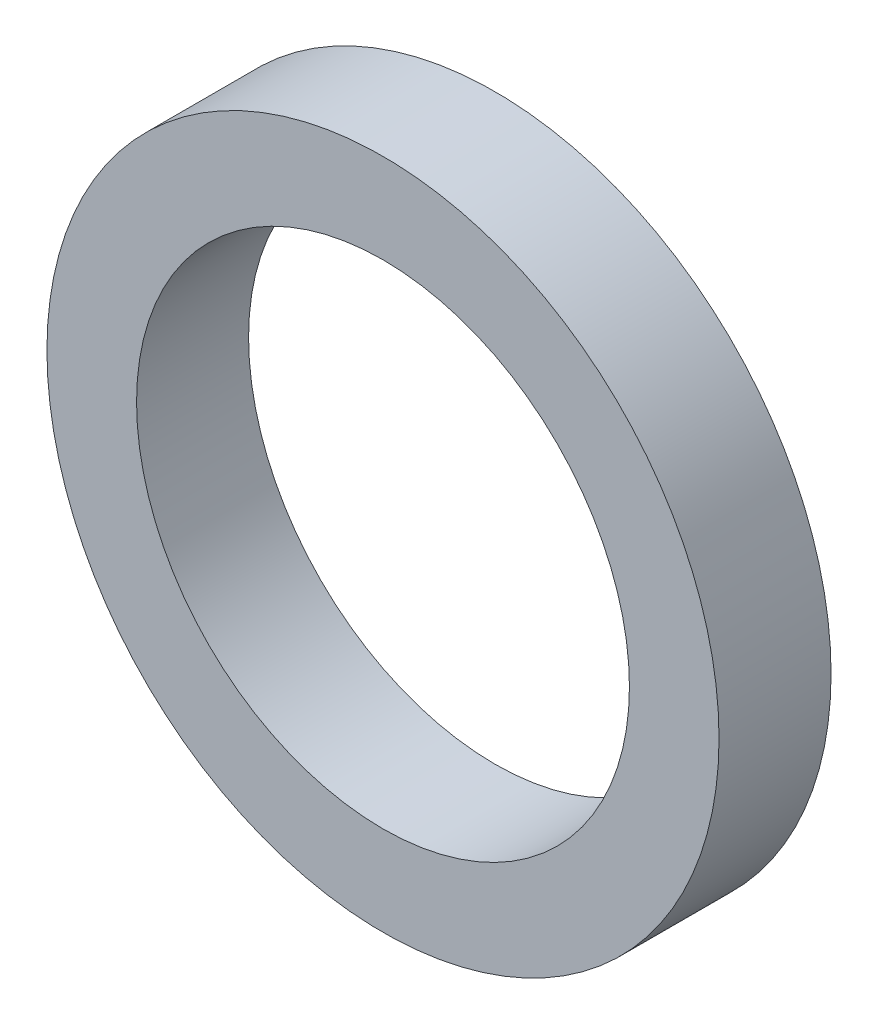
SolidWorks part; units mm, degrees
ref_plane "Plan de face" through (0, 0, 0) normal (0, 0, 1) x (1, 0, 0)
ref_plane "Plan de dessus" through (0, 0, 0) normal (0, 1, 0) x (1, 0, 0)
ref_plane "Plan de droite" through (0, 0, 0) normal (1, 0, 0) x (0, 0, -1)
sketch "Esquisse1" plane through (0, 0, 0) normal (0, 0, 1) x (1, 0, 0)
  circle A0 centre (0, 0) radius 75
extrude "Boss.-Extru.1" add sketch "Esquisse1" along normal blind 25
sketch "Esquisse2" plane through (0, 0, 25) normal (0, 0, 1) x (1, 0, 0)
  circle A0 centre (0, 0) radius 55
extrude "Enlèv. mat.-Extru.1" cut sketch "Esquisse2" against normal blind 66
